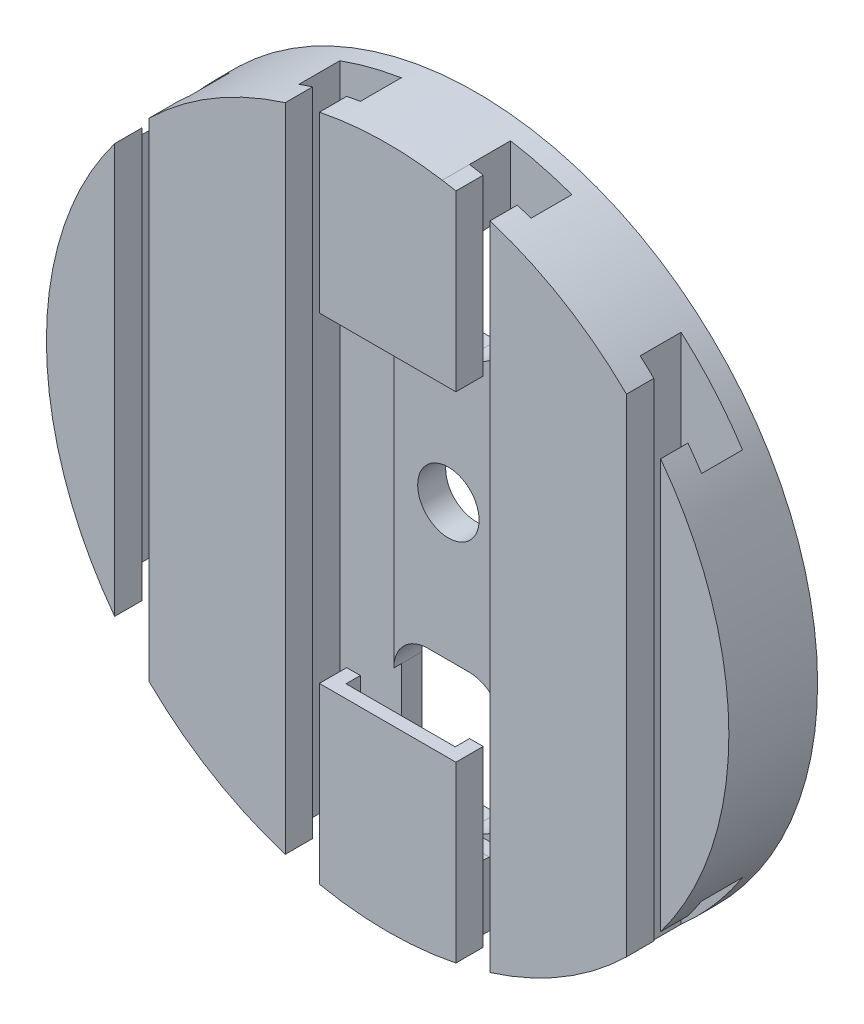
SolidWorks part; units mm, degrees
ref_plane "Plan de face" through (0, 0, 0) normal (0, 0, 1) x (1, 0, 0)
ref_plane "Plan de dessus" through (0, 0, 0) normal (0, 1, 0) x (1, 0, 0)
ref_plane "Plan de droite" through (0, 0, 0) normal (1, 0, 0) x (0, 0, -1)
sketch "Esquisse1" plane through (0, 0, 0) normal (0, 0, 1) x (1, 0, 0)
  line L6 (35.7636, 358.7862) -> (-423.8647, -437.3133) construction
  line L7 (-755.4678, -148.4209) -> (879.7592, -148.4209) construction
  line L8 (-46.1325, 376.7457) -> (415.4529, -422.7436) construction
  line L9 (257.0726, -148.4209) -> (-245.0999, 141.5085) construction
  line L10 (-257.0726, -148.4209) -> (263.2247, 151.9729) construction
  line L11 (-55, 201.5791) -> (55, 201.5791)
  line L12 (-147.0726, -148.4209) -> (147.0726, -148.4209)
  line L13 (147.0726, -148.4209) -> (202.0726, -53.1581)
  line L14 (202.0726, -53.1581) -> (55, 201.5791)
  line L15 (-147.0726, -148.4209) -> (-202.0726, -53.1581)
  line L16 (-202.0726, -53.1581) -> (-55, 201.5791)
  dimension "D1" = 60
  dimension "D2" = 60
  dimension "D3" = 110
  dimension "D4" = 350
  dimension "D5" = 60
  dimension "D6" = 60
  dimension "D7" = 110
  dimension "D8" = 110
extrude "Boss.-Extru.2" add sketch "Esquisse1" along normal blind 13
sketch "Esquisse3" plane through (0, 201.5791, 0) normal (0, 1, 0) x (1, 0, 0)
  line L0 (-12.5, 6.793) -> (-12.5, -19.2478) construction
  line L1 (-8, -3) -> (-17, -3)
  line L2 (-17, -3) -> (-17, -9)
  line L3 (-17, -9) -> (-15, -9)
  line L4 (-15, -9) -> (-15, -13)
  line L5 (55, -13) -> (-55, -13) construction
  line L6 (-10, -9) -> (-10, -13)
  line L7 (-8, -9) -> (-10, -9)
  line L8 (-8, -3) -> (-8, -9)
  line L9 (-15, -13) -> (-10, -13)
  point P2 (-12.5, -13)
  point P14 (-12.5, -3)
  dimension "D1" = 12.5
  dimension "D2" = 9
  dimension "D3" = 5
  dimension "D4" = 6
  dimension "D5" = 4
extrude "Enlèv. mat.-Extru.1" cut sketch "Esquisse3" against normal up to next
pattern_linear "Répétition linéaire1" count 8 spacing 25 along (1, 0, 0) of "Enlèv. mat.-Extru.1"
pattern_linear "Répétition linéaire2" count 7 spacing 25 along (-1, 0, 0) of "Enlèv. mat.-Extru.1"
sketch "3parties" plane through (0, 0, 0) normal (0, 0, 1) x (1, 0, 0)
  line L2 (-50, 0) -> (-171.3817, 0)
  line L3 (-165, 11.0535) -> (-202.0726, -53.1581) construction
  line L4 (50, 0) -> (171.3817, 0)
  line L5 (202.0726, -53.1581) -> (165, 11.0535) construction
  line L6 (0, -50) -> (0, -148.4209)
  line L7 (-10, -148.4209) -> (10, -148.4209) construction
  circle A0 centre (0, 0) radius 50
  dimension "D1" = 100
sketch "certcleRotules" plane through (0, 0, 13) normal (0, 0, 1) x (1, 0, 0)
  circle A0 centre (0, 0) radius 157.5
  dimension "D1" = 315
sketch "Esquisse6" plane through (0, 0, 0) normal (0, 1, 0) x (1, 0, 0)
  line L0 (-157.5, -13) -> (157.5, -13) construction
  line L1 (0, 0) -> (-4.5, 0)
  line L2 (0, 0) -> (0, -13)
  line L3 (-2.5, -9) -> (-4.5, -9)
  line L4 (-4.5, 0) -> (-4.5, -9)
  line L7 (0, -13) -> (-2.5, -13)
  line L8 (-2.5, -9) -> (-2.5, -13)
  dimension "D1" = 4.5
  dimension "D2" = 2.5
  dimension "D3" = 4
revolve "Enlèvement de matière-Révolution1" cut sketch "Esquisse6" angle 360 about L2
pattern_linear "Répétition linéaire3" count 4 spacing 50 along (0, 1, 0) count 4 spacing 50 along (1, 0, 0) of "Enlèvement de matière-Révolution1"
pattern_linear "Répétition linéaire5" count 3 spacing 50 along (0, -1, 0) count 4 spacing 50 along (1, 0, 0) of "Enlèvement de matière-Révolution1"
pattern_linear "Répétition linéaire6" count 4 spacing 50 along (0, 1, 0) count 4 spacing 50 along (-1, 0, 0) of "Enlèvement de matière-Révolution1"
pattern_linear "Répétition linéaire7" count 3 spacing 50 along (0, -1, 0) count 4 spacing 50 along (-1, 0, 0) of "Enlèvement de matière-Révolution1"
sketch "Esquisse8" plane through (0, 0, 0) normal (0, 0, -1) x (-1, 0, 0)
  circle A0 centre (0, 100) radius 4.5 construction
  circle A1 centre (0, 100) radius 4.5
extrude "bouchonBarreauHaut" add sketch "Esquisse8" against normal blind 13
sketch "Esquisse7" plane through (0, 0, 0) normal (0, 0, -1) x (-1, 0, 0)
  line L1 (-6.5, 105.15) -> (6.5, 105.15)
  line L2 (-6.5, 105.15) -> (-6.5, 80.15)
  line L3 (-6.5, 80.15) -> (6.5, 80.15)
  line L4 (6.5, 105.15) -> (6.5, 80.15)
  line L5 (0, 7.15) -> (0, -7.15) construction
  dimension "D1" = 25
  dimension "D2" = 80.15
  dimension "D3" = 13
  dimension "D4" = 6.5
extrude "Boss.-Extru.4" add sketch "Esquisse7" along normal blind 5
sketch "Esquisse9" plane through (0, 0, 0) normal (1, 0, 0) x (0, 0, -1)
  line L0 (5, 80.15) -> (0, 80.15) construction
  line L1 (5, 80.15) -> (5, 105.15) construction
  line L3 (5, 85.15) -> (5, 82.5)
  line L4 (5, 82.5) -> (-3, 82.5)
  line L6 (-3, -148.4209) -> (-3, 201.5791) construction
  line L7 (-13, 157.5) -> (-13, -157.5) construction
  line L8 (-3, 79.15) -> (-13, 79.15)
  line L9 (-3, 79.15) -> (-3, 82.5)
  line L10 (5, 85.15) -> (-13, 85.15)
  line L11 (-13, 79.15) -> (-13, 85.15)
  dimension "D1" = 5
  dimension "D2" = 2.65
  dimension "D3" = 6
revolve "Enlèvement de matière-Révolution2" cut sketch "Esquisse9" angle 360 about L10
pattern_linear "Répétition linéaire8" count 2 spacing 15 along (0, 1, 0) of "Enlèvement de matière-Révolution2"
pattern_circular "Répétition circulaire1" count 3 every 120 about axis through (0, 0, 0) along (0, 0, 1) of "Boss.-Extru.4", "Enlèvement de matière-Révolution2", "Répétition linéaire8"
sketch "Esquisse10" plane through (0, 0, 0) normal (1, 0, 0) x (0, 0, -1)
  line L0 (0, 201.5791) -> (0, -53.1581) construction
  line L1 (0, 77.5) -> (5, 77.5)
  line L2 (0, 77.5) -> (0, 72.5)
  line L3 (0, 72.5) -> (5, 72.5)
  line L4 (5, 77.5) -> (5, 72.5)
  line L5 (0, 50) -> (0, -50) construction
  line L6 (0, -72.5) -> (5, -72.5)
  line L7 (0, -72.5) -> (0, -77.5)
  line L8 (0, -77.5) -> (5, -77.5)
  line L9 (5, -72.5) -> (5, -77.5)
  line L10 (5, 80.15) -> (5, 105.15) construction
  line L11 (-9, 50) -> (0, 50) construction
  line L13 (-9, -100) -> (0, -100) construction
  point P16 (2.5, 72.5)
  point P19 (2.5, -72.5)
  dimension "D1" = 22.5
  dimension "D2" = 5
  dimension "D3" = 22.5
  dimension "D4" = 5
extrude "Boss.-Extru.6" add sketch "Esquisse10" along normal mid plane 215
chamfer "Chanfrein1" distance 5 angle 60 4 edges at (107.5, -75, -5) (-107.5, -75, -5) (-107.5, 75, -5) (107.5, 75, -5)
sketch "Esquisse11" plane through (0, 0, 13) normal (0, 0, 1) x (1, 0, 0)
  line L0 (-10, -148.4209) -> (-10, 201.5791) construction
  line L1 (-10, 23.5) -> (10, 23.5)
  line L2 (-10, 23.5) -> (-10, -23.5)
  line L3 (-10, -23.5) -> (10, -23.5)
  line L4 (10, 23.5) -> (10, -23.5)
  line L5 (10, -148.4209) -> (10, 201.5791) construction
  dimension "D1" = 47
  dimension "D2" = 23.5
extrude "Enlèv. mat.-Extru.2" cut sketch "Esquisse11" against normal blind 8.9
sketch "Esquisse13" plane through (-8, 0, 0) normal (-1, 0, 0) x (0, 0, 1)
  line L1 (4.1, -23.5) -> (11.1, -23.5)
  line L2 (4.1, -23.5) -> (4.1, -40)
  line L3 (4.1, -40) -> (6.1, -40)
  line L4 (11.1, -23.5) -> (11.1, -35)
  arc A0 (6.1, -40) -> (11.1, -35) centre (6.1, -35) ccw
  dimension "D2" = 5
  dimension "D1" = 16.5
  dimension "D3" = 7
extrude "Enlèv. mat.-Extru.3" cut sketch "Esquisse13" against normal up to surface (16 mm away)
sketch "Esquisse14" plane through (0, 0, 4.1) normal (0, 0, 1) x (1, 0, 0)
  line L0 (-8, 23.5) -> (-8, -40) construction
  line L1 (-3, -20) -> (3, -20)
  line L2 (-8, -25) -> (-8, -35)
  line L3 (-3, -40) -> (3, -40)
  line L4 (8, -25) -> (8, -35)
  line L5 (8, -40) -> (8, 23.5) construction
  line L6 (8, -40) -> (-8, -40) construction
  arc A0 (-8, -35) -> (-3, -40) centre (-3, -35) ccw
  arc A1 (3, -40) -> (8, -35) centre (3, -35) ccw
  arc A2 (3, -20) -> (8, -25) centre (3, -25) cw
  arc A3 (-3, -20) -> (-8, -25) centre (-3, -25) ccw
  point P16 (8, -20)
  point P19 (-8, -20)
  dimension "D3" = 5
  dimension "D1" = 20
extrude "Enlèv. mat.-Extru.4" cut sketch "Esquisse14" against normal up to next
mirror "Symétrie1" about plane through (0, 0, 0) normal (0, 1, 0) of "Enlèv. mat.-Extru.4", "Enlèv. mat.-Extru.3"
sketch "Esquisse15" plane through (0, 0, 0) normal (0, 0, -1) x (-1, 0, 0)
  circle A0 centre (-50, 0) radius 4.5 construction
  circle A1 centre (0, -50) radius 4.5 construction
  circle A2 centre (50, 0) radius 4.5 construction
  circle A3 centre (0, 50) radius 4.5 construction
  circle A4 centre (-50, 0) radius 4.5
  circle A5 centre (0, -50) radius 4.5
  circle A6 centre (50, 0) radius 4.5
  circle A7 centre (0, 50) radius 4.5
extrude "boucheTrousCEntre" add sketch "Esquisse15" against normal up to surface (13 mm away)
sketch "Esquisse17" plane through (0, 0, -5) normal (0, 0, -1) x (-1, 0, 0)
  line L17 (-147.0726, -148.4209) -> (147.0726, -148.4209)
  line L18 (55, 201.5791) -> (-55, 201.5791)
  line L19 (-55, 201.5791) -> (-202.0726, -53.1581)
  line L20 (-202.0726, -53.1581) -> (-147.0726, -148.4209)
  line L21 (147.0726, -148.4209) -> (202.0726, -53.1581)
  line L22 (202.0726, -53.1581) -> (55, 201.5791)
  circle A3 centre (0, 0) radius 50
extrude "Enlèv. mat.-Extru.11" cut sketch "Esquisse17" against normal through all
